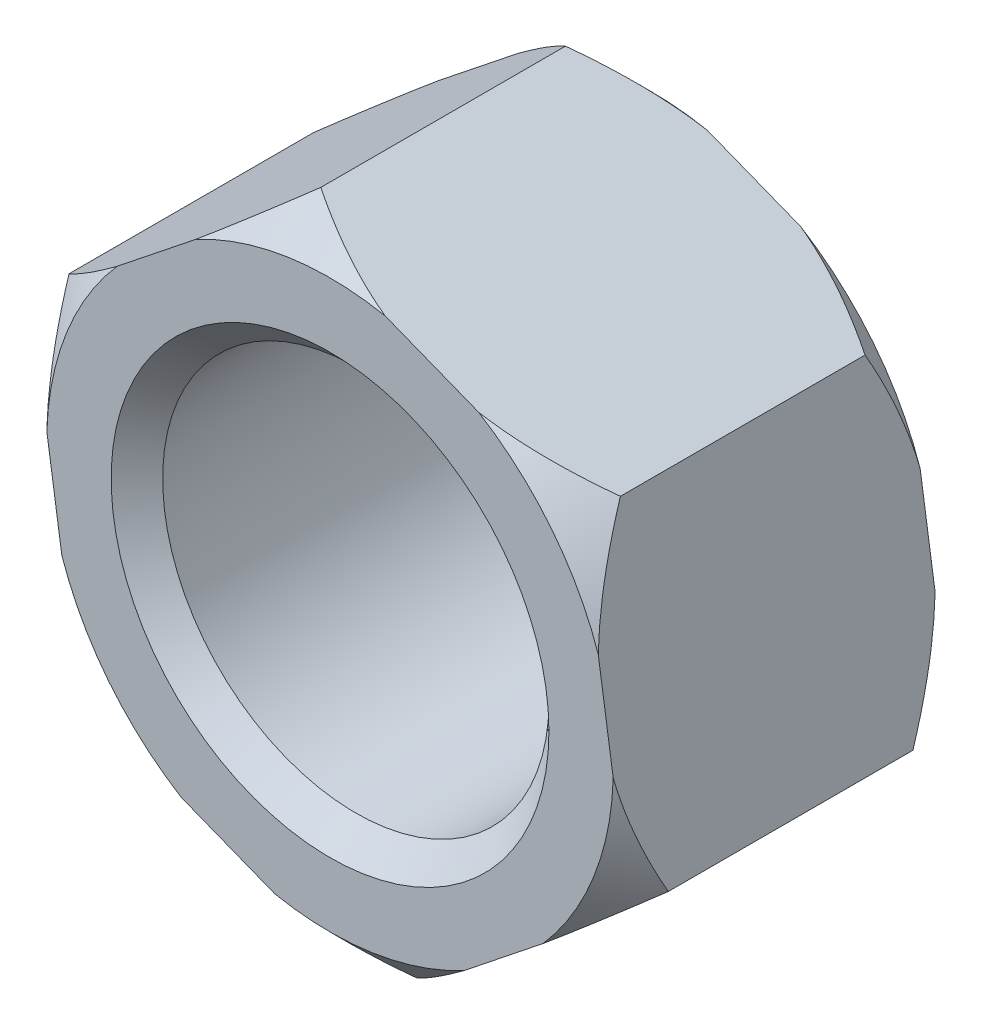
SolidWorks part; units mm, degrees
ref_plane "Plan de face" through (0, 0, 0) normal (0, 0, 1) x (1, 0, 0)
ref_plane "Plan de dessus" through (0, 0, 0) normal (0, 1, 0) x (1, 0, 0)
ref_plane "Plan de droite" through (0, 0, 0) normal (1, 0, 0) x (0, 0, -1)
sketch "Esquisse1" plane through (0, 0, 0) normal (0, 0, 1) x (1, 0, 0)
  circle A0 centre (0, 0) radius 2.5
  dimension "D1" = 5
extrude "Boss.-Extru.1" add sketch "Esquisse1" along normal blind 2.5
chamfer "Chanfrein1" distance 0.3 angle 45 2 edges at (2.5, 0, 0) (2.5, 0, 2.5)
sketch "Esquisse2" plane through (0, 0, 2.5) normal (0, 0, 1) x (1, 0, 0)
  circle A0 centre (0, 0) radius 1.5
  dimension "D1" = 3
extrude "Enlèv. mat.-Extru.1" cut sketch "Esquisse2" against normal through all
chamfer "Chanfrein2" distance 0.2 angle 45 2 edges at (1.5, 0, 0) (1.5, 0, 2.5)
sketch "Esquisse3" plane through (0, 0, 2.5) normal (0, 0, 1) x (1, 0, 0)
  line L6 (-2.3269, 0.914) -> (-0.3719, 2.4722)
  arc A1 (-2.3269, 0.914) -> (-0.3719, 2.4722) centre (0, 0) cw
  point P12 (0, 0)
extrude "Enlèv. mat.-Extru.2" cut sketch "Esquisse3" against normal blind 5
pattern_circular "Répétition circulaire1" count 6 every 60 about axis through (0, 0, 0) along (0, 0, 1) of "Enlèv. mat.-Extru.2"
